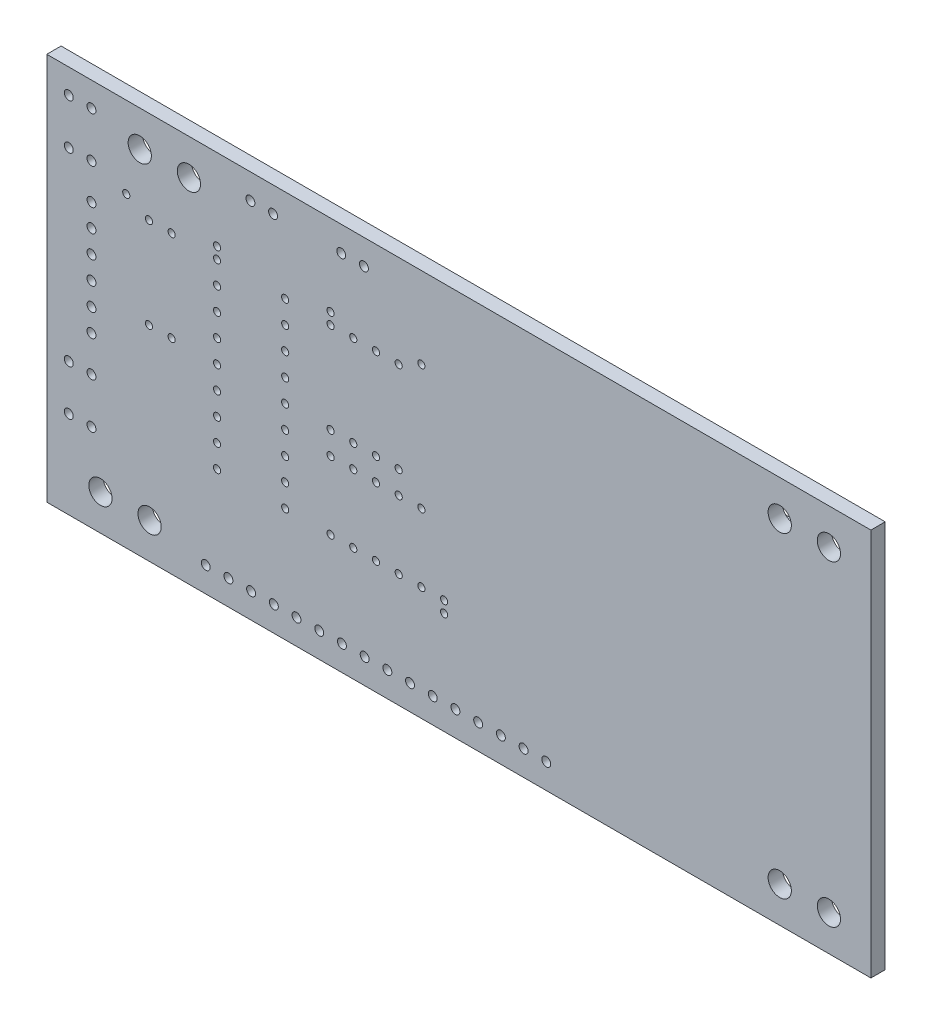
SolidWorks part; units mm, degrees
ref_plane "Plan de face" through (0, 0, 0) normal (0, 0, 1) x (1, 0, 0)
ref_plane "Plan de dessus" through (0, 0, 0) normal (0, 1, 0) x (1, 0, 0)
ref_plane "Plan de droite" through (0, 0, 0) normal (1, 0, 0) x (0, 0, -1)
sketch "Esquisse1" plane through (0, 0, 0) normal (0, 0, 1) x (1, 0, 0)
  line L0 (0, -29.2621) -> (0, 57.4681) construction
  line L1 (0, 0) -> (92.2, 0)
  line L2 (0, 0) -> (0, 43.4)
  line L3 (0, 43.4) -> (92.2, 43.4)
  line L4 (92.2, 0) -> (92.2, 43.4)
  line L5 (5, 48.5432) -> (5, 6.0543) construction
  line L6 (97.1827, 21.7) -> (84.0955, 21.7) construction
  line L7 (-8.2241, 4) -> (94.3535, 4) construction
  line L8 (6, -3.8736) -> (6, 7.0971) construction
  line L9 (11.5, 7.0971) -> (11.5, -8.2628) construction
  line L10 (87.5, 7.0971) -> (87.5, -29.2621) construction
  line L11 (82, 7.0971) -> (82, -25.9099) construction
  line L12 (-8.2241, 0) -> (97.1827, 0) construction
  line L13 (22.78, 39.4) -> (22.78, 54.9033) construction
  line L14 (10.4, 57.4681) -> (10.4, 37.4709) construction
  line L15 (-4.2384, 40.6) -> (39.4972, 40.6) construction
  line L16 (15.9, 57.4681) -> (15.9, 37.4709) construction
  line L17 (13.1027, 2.8) -> (78.6127, 2.8) construction
  line L18 (17.78, -12.303) -> (17.78, 6.0543) construction
  line L19 (19.05, -3.8736) -> (19.05, 37.4709) construction
  line L20 (-5.8589, 35.5838) -> (8.635, 35.5838) construction
  line L21 (-5.8589, 34.3138) -> (20.32, 34.3138) construction
  line L22 (-5.8589, 33.0438) -> (20.32, 33.0438) construction
  circle A0 centre (6, 4) radius 1.3
  circle A1 centre (11.5, 4) radius 1.3
  circle A2 centre (82, 4) radius 1.3
  circle A3 centre (87.5, 4) radius 1.3
  circle A4 centre (10.4, 39.4) radius 1.3
  circle A5 centre (15.9, 39.4) radius 1.3
  circle A6 centre (82, 39.4) radius 1.3
  circle A7 centre (87.5, 39.4) radius 1.3
  circle A8 centre (5, 40.6638) radius 0.5
  circle A9 centre (5, 35.5838) radius 0.5
  circle A10 centre (8.89, 34.3138) radius 0.4
  circle A11 centre (13.97, 33.0438) radius 0.4
  circle A12 centre (13.97, 22.8838) radius 0.4
  circle A13 centre (11.43, 33.0438) radius 0.4
  circle A14 centre (5, 21.4238) radius 0.5
  circle A15 centre (5, 18.8838) radius 0.5
  circle A16 centre (5, 14.8838) radius 0.5
  circle A17 centre (5, 9.8038) radius 0.5
  circle A18 centre (2.46, 9.8038) radius 0.5
  circle A19 centre (2.46, 14.8838) radius 0.5
  circle A20 centre (2.46, 35.5838) radius 0.5
  circle A21 centre (2.46, 40.6638) radius 0.5
  circle A22 centre (22.78, 40.6) radius 0.5
  circle A23 centre (25.32, 40.6) radius 0.5
  circle A24 centre (17.78, 2.8) radius 0.5
  circle A25 centre (20.32, 2.8) radius 0.5
  circle A26 centre (32.94, 40.6) radius 0.5
  circle A27 centre (35.48, 40.6) radius 0.5
  circle A28 centre (30.4, 40.6) radius 0.5
  circle A29 centre (27.86, 40.6) radius 0.5
  circle A30 centre (22.86, 2.8) radius 0.5
  circle A31 centre (25.4, 2.8) radius 0.5
  circle A32 centre (27.94, 2.8) radius 0.5
  circle A33 centre (30.48, 2.8) radius 0.5
  circle A34 centre (33.02, 2.8) radius 0.5
  circle A35 centre (35.56, 2.8) radius 0.5
  circle A36 centre (38.1, 2.8) radius 0.5
  circle A37 centre (40.64, 2.8) radius 0.5
  circle A38 centre (43.18, 2.8) radius 0.5
  circle A39 centre (45.72, 2.8) radius 0.5
  circle A40 centre (48.26, 2.8) radius 0.5
  circle A41 centre (50.8, 2.8) radius 0.5
  circle A42 centre (53.34, 2.8) radius 0.5
  circle A43 centre (55.88, 2.8) radius 0.5
  circle A44 centre (19.05, 34.3138) radius 0.4
  circle A45 centre (19.05, 33.0438) radius 0.4
  circle A46 centre (19.05, 30.5038) radius 0.4
  circle A47 centre (19.05, 27.9638) radius 0.4
  circle A48 centre (19.05, 25.4238) radius 0.4
  circle A49 centre (19.05, 22.8838) radius 0.4
  circle A50 centre (19.05, 20.3438) radius 0.4
  circle A51 centre (19.05, 17.8038) radius 0.4
  circle A52 centre (19.05, 15.2638) radius 0.4
  circle A53 centre (19.05, 12.7238) radius 0.4
  circle A54 centre (44.45, 11.4538) radius 0.4
  circle A55 centre (11.43, 22.8838) radius 0.4
  circle A56 centre (5, 23.9638) radius 0.5
  circle A57 centre (5, 26.5038) radius 0.5
  circle A58 centre (5, 29.0438) radius 0.5
  circle A59 centre (5, 31.5838) radius 0.5
  circle A75 centre (26.67, 33.0438) radius 0.4
  circle A76 centre (26.67, 30.5038) radius 0.4
  circle A77 centre (26.67, 27.9638) radius 0.4
  circle A78 centre (26.67, 25.4238) radius 0.4
  circle A79 centre (26.67, 22.8838) radius 0.4
  circle A80 centre (26.67, 20.3438) radius 0.4
  circle A81 centre (26.67, 17.8038) radius 0.4
  circle A82 centre (26.67, 15.2638) radius 0.4
  circle A83 centre (26.67, 12.7238) radius 0.4
  circle A94 centre (31.75, 34.3138) radius 0.4
  circle A95 centre (31.75, 33.0438) radius 0.4
  circle A99 centre (31.75, 22.8838) radius 0.4
  circle A100 centre (31.75, 20.3438) radius 0.4
  circle A103 centre (31.75, 12.7238) radius 0.4
  circle A105 centre (34.29, 33.0438) radius 0.4
  circle A109 centre (34.29, 22.8838) radius 0.4
  circle A110 centre (34.29, 20.3438) radius 0.4
  circle A113 centre (34.29, 12.7238) radius 0.4
  circle A115 centre (36.83, 33.0438) radius 0.4
  circle A119 centre (36.83, 22.8838) radius 0.4
  circle A120 centre (36.83, 20.3438) radius 0.4
  circle A123 centre (36.83, 12.7238) radius 0.4
  circle A125 centre (39.37, 33.0438) radius 0.4
  circle A129 centre (39.37, 22.8838) radius 0.4
  circle A130 centre (39.37, 20.3438) radius 0.4
  circle A133 centre (39.37, 12.7238) radius 0.4
  circle A134 centre (41.91, 34.3138) radius 0.4
  circle A140 centre (41.91, 20.3438) radius 0.4
  circle A143 centre (41.91, 12.7238) radius 0.4
  circle A153 centre (44.45, 12.7238) radius 0.4
  circle A154 centre (21.59, 34.3138) radius 0.4
  circle A155 centre (21.59, 33.0438) radius 0.4
  circle A156 centre (21.59, 30.5038) radius 0.4
  circle A157 centre (21.59, 27.9638) radius 0.4
  circle A158 centre (21.59, 25.4238) radius 0.4
  circle A159 centre (21.59, 22.8838) radius 0.4
  circle A160 centre (21.59, 20.3438) radius 0.4
  circle A161 centre (21.59, 17.8038) radius 0.4
  circle A162 centre (21.59, 15.2638) radius 0.4
  circle A163 centre (21.59, 12.7238) radius 0.4
  circle A164 centre (24.13, 34.3138) radius 0.4
  circle A165 centre (24.13, 33.0438) radius 0.4
  circle A166 centre (24.13, 30.5038) radius 0.4
  circle A167 centre (24.13, 27.9638) radius 0.4
  circle A168 centre (24.13, 25.4238) radius 0.4
  circle A169 centre (24.13, 22.8838) radius 0.4
  circle A170 centre (24.13, 20.3438) radius 0.4
  circle A171 centre (24.13, 17.8038) radius 0.4
  circle A172 centre (24.13, 15.2638) radius 0.4
  circle A173 centre (24.13, 12.7238) radius 0.4
  circle A174 centre (29.21, 34.3138) radius 0.4
  circle A175 centre (29.21, 33.0438) radius 0.4
  circle A176 centre (29.21, 30.5038) radius 0.4
  circle A177 centre (29.21, 27.9638) radius 0.4
  circle A178 centre (29.21, 25.4238) radius 0.4
  circle A179 centre (29.21, 22.8838) radius 0.4
  circle A180 centre (29.21, 20.3438) radius 0.4
  circle A181 centre (29.21, 17.8038) radius 0.4
  circle A182 centre (29.21, 15.2638) radius 0.4
  circle A183 centre (29.21, 12.7238) radius 0.4
  circle A184 centre (26.67, 34.3138) radius 0.4
  circle A185 centre (34.29, 34.3138) radius 0.4
  circle A186 centre (36.83, 34.3138) radius 0.4
  circle A187 centre (39.37, 34.3138) radius 0.4
  circle A188 centre (44.45, 34.3138) radius 0.4
  circle A189 centre (44.45, 33.0438) radius 0.4
  circle A190 centre (44.45, 30.5038) radius 0.4
  circle A191 centre (44.45, 27.9638) radius 0.4
  circle A192 centre (44.45, 25.4238) radius 0.4
  circle A193 centre (44.45, 22.8838) radius 0.4
  circle A194 centre (44.45, 20.3438) radius 0.4
  circle A195 centre (44.45, 17.8038) radius 0.4
  circle A196 centre (44.45, 15.2638) radius 0.4
  circle A197 centre (31.75, 30.5038) radius 0.4
  circle A198 centre (31.75, 27.9638) radius 0.4
  circle A199 centre (31.75, 25.4238) radius 0.4
  circle A200 centre (34.29, 30.5038) radius 0.4
  circle A201 centre (34.29, 27.9638) radius 0.4
  circle A202 centre (34.29, 25.4238) radius 0.4
  circle A203 centre (36.83, 30.5038) radius 0.4
  circle A204 centre (36.83, 27.9638) radius 0.4
  circle A205 centre (36.83, 25.4238) radius 0.4
  circle A206 centre (39.37, 30.5038) radius 0.4
  circle A207 centre (39.37, 27.9638) radius 0.4
  circle A208 centre (39.37, 25.4238) radius 0.4
  circle A209 centre (41.91, 30.5038) radius 0.4
  circle A210 centre (41.91, 27.9638) radius 0.4
  circle A211 centre (41.91, 25.4238) radius 0.4
  circle A212 centre (41.91, 33.0438) radius 0.4
  circle A213 centre (31.75, 17.8038) radius 0.4
  circle A214 centre (31.75, 15.2638) radius 0.4
  circle A215 centre (34.29, 17.8038) radius 0.4
  circle A216 centre (34.29, 15.2638) radius 0.4
  circle A217 centre (36.83, 17.8038) radius 0.4
  circle A218 centre (36.83, 15.2638) radius 0.4
  circle A219 centre (39.37, 17.8038) radius 0.4
  circle A220 centre (39.37, 15.2638) radius 0.4
  circle A221 centre (41.91, 17.8038) radius 0.4
  circle A222 centre (41.91, 15.2638) radius 0.4
  circle A223 centre (41.91, 22.8838) radius 0.4
  circle A224 centre (5, 31.5838) radius 0.5
  circle A225 centre (5, 29.0438) radius 0.5
  circle A226 centre (5, 26.5038) radius 0.5
  circle A227 centre (5, 23.9638) radius 0.5
  dimension "D7" = 21.7
  dimension "D10" = 2.8
  dimension "D12" = 17.78
  dimension "D14" = 1.27
  dimension "D16" = 1.27
  dimension "D17" = 6
  dimension "D1" = 5
  dimension "D2" = 6
  dimension "D3" = 11.5
  dimension "D4" = 4
  dimension "D5" = 82
  dimension "D6" = 87.5
  dimension "D8" = 5.5
  dimension "D9" = 10.4
  dimension "D11" = 17.78
  dimension "D13" = 2.8
  dimension "D15" = 1.27
  dimension "D18" = 5
extrude "Extrusion1" add sketch "Esquisse1" along normal blind 1.6
sketch "Esquisse2" plane through (0, 0, 0) normal (0, 0, -1) x (-1, 0, 0)
  line L0 (-72.75, -2.3408) -> (-72.75, 49.6121) construction
  line L1 (-99.2946, 0) -> (-76.9318, 0) construction
  line L2 (-108.0419, 4.3) -> (-68.2197, 4.3) construction
  line L3 (-108.0419, 32.3) -> (-63.2629, 32.3) construction
  line L4 (-76.05, 37.1016) -> (-76.05, 24.3029) construction
  line L5 (-99.2946, 15.7) -> (-57.205, 15.7) construction
  line L6 (-69.45, 37.1016) -> (-69.45, 24.7016) construction
  line L7 (-92.2, 53.3014) -> (-92.2, 31.4589) construction
  line L8 (-76.05, 32.3) -> (-69.45, 32.3)
  line L9 (-76.05, 32.3) -> (-76.05, 26.6119)
  line L10 (-44.5, 53.3014) -> (-44.5, 15.0182) construction
  line L11 (-69.45, 32.3) -> (-69.45, 26.6119)
  line L12 (-41.9293, 28.1) -> (-60.0922, 28.1) construction
  line L13 (-55.5, 37.1016) -> (-55.5, 13.8439) construction
  line L14 (-43.0253, 18.1) -> (-59.2311, 18.1) construction
  line L15 (-92.2, 43.4) -> (0, 43.4) construction
  line L17 (-54.5, 28.1) -> (-45.5, 28.1)
  line L18 (-55.5, 27.1) -> (-55.5, 19.1)
  line L19 (-54.5, 18.1) -> (-45.5, 18.1)
  line L20 (-44.5, 27.1) -> (-44.5, 19.1)
  arc A0 (-76.05, 26.6119) -> (-69.45, 26.6119) centre (-72.75, 15.7) ccw
  arc A1 (-54.5, 28.1) -> (-55.5, 27.1) centre (-54.5, 27.1) ccw
  arc A2 (-45.5, 28.1) -> (-44.5, 27.1) centre (-45.5, 27.1) cw
  arc A3 (-45.5, 18.1) -> (-44.5, 19.1) centre (-45.5, 19.1) ccw
  arc A4 (-55.5, 19.1) -> (-54.5, 18.1) centre (-54.5, 19.1) ccw
  dimension "D10" = 1
  dimension "D1" = 4.3
  dimension "D2" = 11.4
  dimension "D3" = 28
  dimension "D4" = 3.3
  dimension "D5" = 6.6
  dimension "D6" = 47.7
  dimension "D7" = 25.3
  dimension "D8" = 10
  dimension "D9" = 11
extrude "Extrusion2" add sketch "Esquisse2" along normal blind 6.2
sketch "Esquisse3" plane through (0, 0, -6.2) normal (0, 0, -1) x (-1, 0, 0)
  line L0 (-75.9246, 15.7) -> (-57.6577, 15.7) construction
  line L1 (-72.75, 18.6075) -> (-72.75, 3.3163) construction
  circle A0 centre (-72.75, 15.7) radius 9.8
extrude "Enlèv. mat.-Extru.1" cut sketch "Esquisse3" against normal blind 3.7
sketch "Esquisse4" plane through (0, 0, -6.2) normal (0, 0, -1) x (-1, 0, 0)
  line L1 (-58.5362, 20.3) -> (-86.646, 20.3) construction
  line L2 (-62.4379, 4.3) -> (-78.1776, 4.3) construction
  line L3 (-84.8281, 20.3) -> (-60.6644, 20.3)
  line L4 (-84.8281, 20.3) -> (-84.8281, 4.3)
  line L5 (-84.8281, 4.3) -> (-60.6644, 4.3)
  line L6 (-60.6644, 20.3) -> (-60.6644, 4.3)
  dimension "D1" = 16
extrude "Enlèv. mat.-Extru.3" cut sketch "Esquisse4" against normal blind 1.5
sketch "Esquisse5" plane through (0, 0, -6.2) normal (0, 0, -1) x (-1, 0, 0)
  line L0 (-72.75, 32.8286) -> (-72.75, 26.4147) construction
  line L1 (-68.7536, 29.8) -> (-77.1703, 29.8) construction
  line L2 (-77.3984, 32.3) -> (-68.5001, 32.3) construction
  line L3 (-70.95, 27.2766) -> (-70.95, 30.699) construction
  line L4 (-74.55, 27.2766) -> (-74.55, 30.699) construction
  line L5 (-69.1168, 29.4) -> (-75.3063, 29.4) construction
  line L6 (-75.3063, 29) -> (-68.7536, 29) construction
  line L8 (-74.55, 29.8) -> (-70.95, 29.8)
  line L9 (-74.55, 29.8) -> (-74.55, 29)
  line L10 (-74.55, 29) -> (-70.95, 29)
  line L11 (-70.95, 29.8) -> (-70.95, 29)
  dimension "D1" = 2.5
  dimension "D2" = 1.8
  dimension "D3" = 3.6
  dimension "D4" = 0.8
  dimension "D5" = 0.4
ref_plane "Plan1" through (72.75, 0, 0) normal (1, 0, 0) x (0, 0, -1)
sketch "Esquisse6" plane through (72.75, 0, 0) normal (1, 0, 0) x (0, 0, -1)
  line L0 (6.2, 29.4) -> (6.4035, 29.4)
  line L1 (6.8035, 29) -> (6.8035, 20.3463)
  line L2 (6.6764, 19.2259) -> (5.2537, 13.0386)
  line L3 (5.3902, 10.3162) -> (5.618, 9.6426)
  arc A0 (6.4035, 29.4) -> (6.8035, 29) centre (6.4035, 29) cw
  arc A1 (6.8035, 20.3463) -> (6.6764, 19.2259) centre (1.8035, 20.3463) cw
  arc A2 (5.2537, 13.0386) -> (5.3902, 10.3162) centre (10.1266, 11.9182) ccw
  dimension "D1" = 0.4
  dimension "D2" = 5
sweep "Balayage1" add profiles "Esquisse5" path "Esquisse6"
sketch "Esquisse7" plane through (0, 0, -6.2) normal (0, 0, -1) x (-1, 0, 0)
  line L0 (-43.8834, 23.1) -> (-51.7477, 23.1) construction
  line L1 (-49.2, 26.1785) -> (-49.2, 18.1) construction
  line L2 (-45.5, 28.1) -> (-54.5, 28.1) construction
  line L3 (-44.5, 19.1) -> (-44.5, 27.1) construction
  circle A0 centre (-49.2, 23.1) radius 1.5
  dimension "D1" = 5
  dimension "D2" = 4.7
extrude "Enlèv. mat.-Extru.4" cut sketch "Esquisse7" against normal blind 1
sketch "Esquisse8" plane through (0, 0, 0) normal (0, 0, -1) x (-1, 0, 0)
  line L0 (-5, -3.274) -> (-5, 32.8519) construction
  line L1 (-6.4335, 23.9638) -> (2.1562, 23.9638) construction
  line L2 (-6.4335, 27.7738) -> (2.1562, 27.7738) construction
  line L3 (-5.8, 31.5838) -> (-5.8, 23.9638)
  line L4 (-4.2, 23.9638) -> (-4.2, 31.5838)
  arc A0 (-5.8, 23.9638) -> (-4.2, 23.9638) centre (-5, 23.9638) ccw
  arc A1 (-5.8, 31.5838) -> (-4.2, 31.5838) centre (-5, 31.5838) cw
  dimension "D1" = 3.81
ref_plane "Plan3" through (0, 27.77, 0) normal (0, 1, 0) x (-1, 0, 0)
sketch3d "Esquisse3D1"
  line L0 (5, 27.7738, 0) -> (5, 27.7738, -5.8851)
  line L3 (5, -3.274, 0) -> (5, 32.8519, 0) construction
  line L4 (6.4335, 27.7738, 0) -> (-2.1562, 27.7738, 0) construction
  line L13 (4.7164, 27.362, -6.3851) -> (-7.1166, 10.1818, -6.3851)
  line L14 (-7.4002, 9.77, -5.8851) -> (-7.4002, 9.77, -4.5163)
  line L15 (-7.4002, 9.77, -2.9) -> (-7.4002, 9.77, -4.5) construction
  arc A0 (5, 27.7738, -5.8851) -> (4.7164, 27.362, -6.3851) centre (4.7164, 27.362, -5.8851) ccw
  arc A2 (-7.1166, 10.1818, -6.3851) -> (-7.4002, 9.77, -5.8851) centre (-7.1166, 10.1818, -5.8851) ccw
  point P12 (5, 27.7738, -6.3851)
  point P13 (4.3046, 27.6456, -5.8851)
  point P16 (-7.4002, 9.77, -6.3851)
  point P17 (-7.5284, 10.4654, -5.8851)
  dimension "D1" = 0.5
